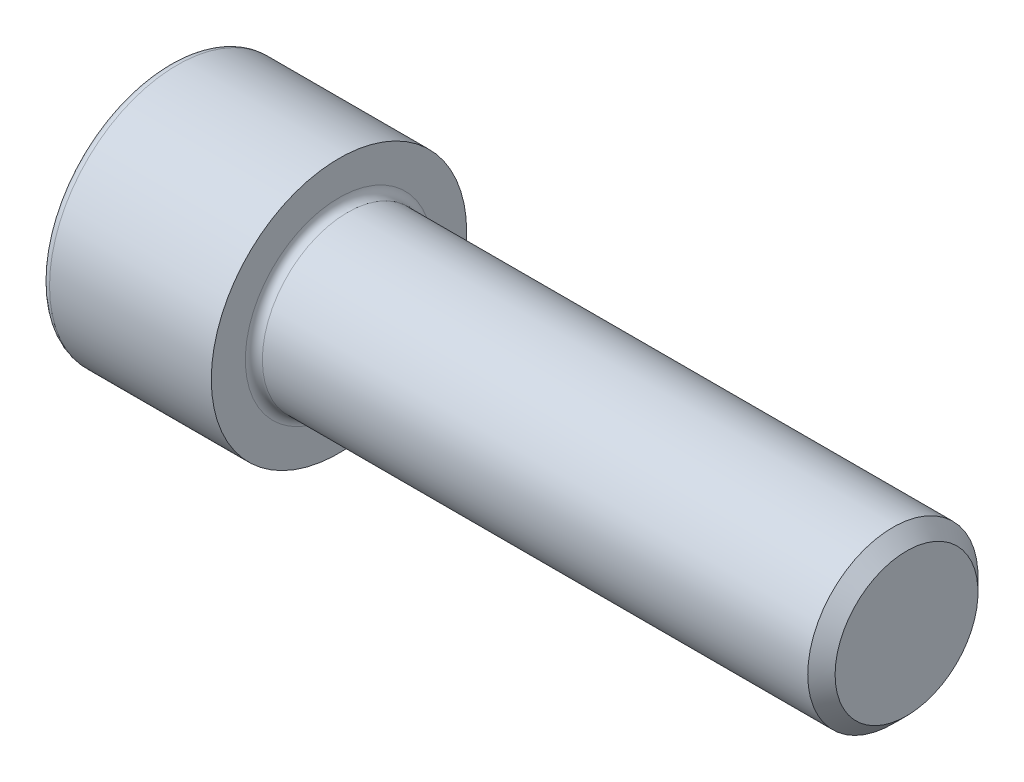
SolidWorks part; units mm, degrees
ref_plane "Plane1" through (0, 0, 0) normal (0, 0, 1) x (1, 0, 0)
ref_plane "Plane2" through (0, 0, 0) normal (0, 1, 0) x (1, 0, 0)
ref_plane "Plane3" through (0, 0, 0) normal (1, 0, 0) x (0, 0, -1)
sketch "BodySke" plane through (0, 0, 0) normal (0, 0, 1) x (1, 0, 0)
  line L0 (0, 0) -> (0, 9)
  line L1 (0, 9) -> (12, 9)
  line L2 (12, 9) -> (12, 6)
  line L3 (12, 6) -> (51.036, 6)
  line L4 (52, 5.036) -> (52, 0)
  line L5 (52, 0) -> (0, 0)
  line L6 (-31.75, 0) -> (127, 0) construction
  line L8 (52, 5.036) -> (51.036, 6)
  line L10 (52, -5.036) -> (51.036, -6) construction
  line L11 (13.75, 9.525) -> (13.75, 3.175) construction
  line L12 (16, 9.525) -> (16, 3.175) construction
  line L13 (-8, 9.525) -> (-8, 3.175) construction
  dimension "Diameter" = 12
  dimension "Head_ht" = 12
  dimension "Length" = 40
  dimension "Body_ch_ang" = 45
  dimension "Head_dia" = 18
  dimension "Minor_dia" = 10.072
  dimension "Advance" = 1.75
  dimension "Thread_nom" = 36
  dimension "Thread_length" = 60
revolve "Base-Revolve" add sketch "BodySke"
fillet "Fillet1" radius 0.6 1 edges at (12, 0, 6)
fillet "Fillet2" radius 0.6 1 edges at (0, 0, 9)
sketch "Sketch2" plane through (0, 0, 0) normal (0, 0, 1) x (1, 0, 0)
  line L0 (0, 5.0575) -> (6, 5.0575)
  line L1 (6, 5.0575) -> (8.9199, 0)
  line L2 (-31.75, 0) -> (127, 0) construction
  line L3 (8.9199, 0) -> (0, 0)
  line L4 (0, 0) -> (0, 5.0575)
  line L6 (0, 0) -> (47.625, 0) construction
  dimension "D1" = 5.0575
  dimension "D2" = 60
  dimension "Depth" = 6
revolve "Hex-PreBroach" cut sketch "Sketch2" angle 360 about L6
sketch "Sketch3" plane through (0, 0, 0) normal (-1, 0, 0) x (0, 0.5, 0.866)
  line L0 (2.9199, 5.0575) -> (-2.9199, 5.0575)
  line L1 (-2.9199, 5.0575) -> (-5.8399, 0)
  line L2 (2.9199, 5.0575) -> (5.8399, 0)
  line L3 (2.9199, -5.0575) -> (5.8399, 0)
  line L4 (2.9199, -5.0575) -> (-2.9199, -5.0575)
  line L5 (-2.9199, -5.0575) -> (-5.8399, 0)
  dimension "D1" = 5.0575
  dimension "D2" = 5.0575
  dimension "Hex_size" = 10.115
extrude "Hex" cut sketch "Sketch3" against normal blind 6
sketch "ThdSchSke" plane through (0, 0, 0) normal (0, 0, 1) x (1, 0, 0)
  line L0 (17.25, -5.036) -> (16.575, -6)
  line L1 (17.25, -5.036) -> (17.925, -6)
  line L2 (17.925, -6) -> (17.925, -7.5)
  line L3 (-3.175, 0) -> (5.1513, 0) construction
  line L4 (0, 8.4) -> (0, -8.4) construction
  line L5 (17.925, -7.5) -> (16.575, -7.5)
  line L6 (16.575, -7.5) -> (16.575, -6)
  dimension "Thread_minor" = 10.072
  dimension "Diameter" = 12
  dimension "Start" = 17.25
  dimension "SideAngle" = 55
  dimension "VeeAngle" = 70
  dimension "Overcut" = 15
revolve "ThreadSchematic" [suppressed] cut sketch "ThdSchSke" angle 360 about L3
pattern_linear "ThdSchPat" [suppressed]
equation "\"D2@Sketch3\" = \"Hex_size@Sketch3\" / 2"
equation "\"D1@Sketch3\" = \"Hex_size@Sketch3\" / 2"
equation "\"D1@Sketch2\" = \"Hex_size@Sketch3\" / 2"
equation "\"Thread_minor@ThreadCosmetic\"  =  \"Minor_dia@BodySke\""
equation "\"Depth@Sketch2\" =  \"Key_eng@Hex\""
equation "\"Thread_length@ThreadCosmetic\" = ((sgn( (\"Length@BodySke\" - \"Advance@BodySke\" * 3.0) - \"Thread_nom@BodySke\" )-1)*( (\"Length@BodySke\" - \"Advance@BodySke\" * 3.0) - \"Thread_nom@BodySke\" ))/-2+ \"Thread_no"
equation "\"Thread_minor@ThdSchSke\" = \"Minor_dia@BodySke\""
equation "\"Diameter@ThdSchSke\" = \"Diameter@BodySke\""
equation "\"Overcut@ThdSchSke\" = \"Diameter@BodySke\" * 1.25"
equation "\"Start@ThdSchSke\" = \"Head_ht@BodySke\" + \"Length@BodySke\" - \"Thread_length@ThreadCosmetic\"  '---Non-countersunk---"
equation "\"Num_threads@ThdSchPat\" = int( \"Thread_length@ThreadCosmetic\" / \"Advance@BodySke\" + 0.999 )  + 1"
equation "\"Advance@ThdSchPat\" = \"Thread_length@ThreadCosmetic\" /  (\"Num_threads@ThdSchPat\" - 1) 'relax it"
equation "\"Num_threads@ThdSchPat\" = \"Num_threads@ThdSchPat\" - sgn( \"Num_threads@ThdSchPat\" - 1) '---chamfered tips only---"
